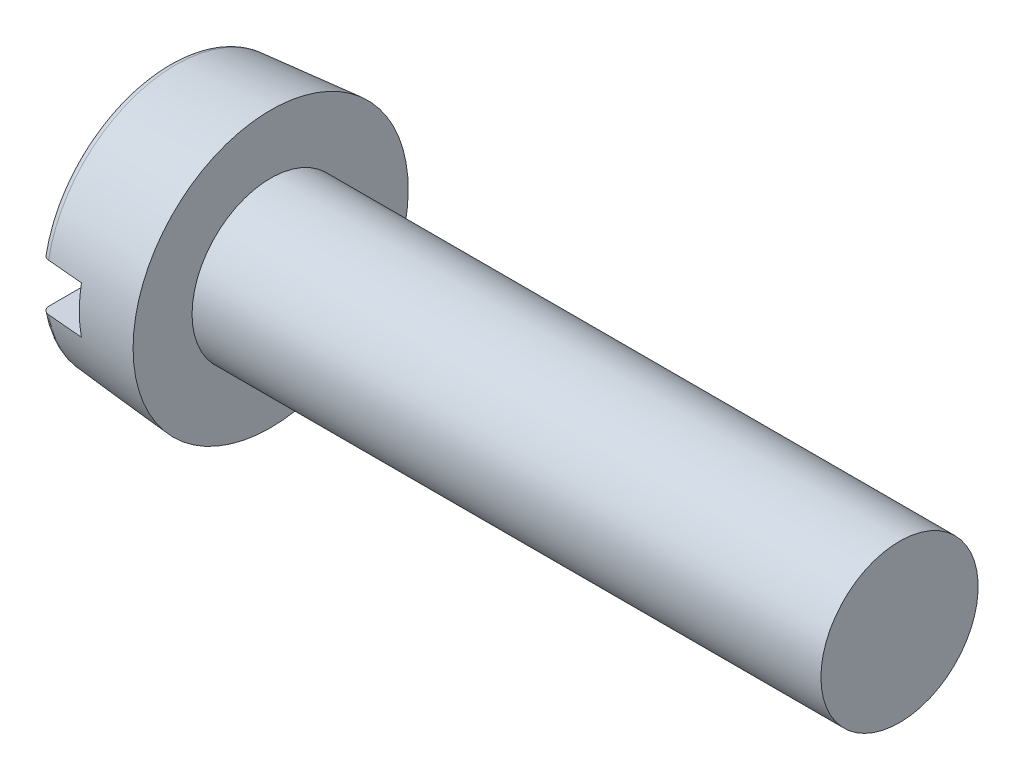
SolidWorks part; units mm, degrees
ref_plane "Plane1" through (0, 0, 0) normal (0, 0, 1) x (1, 0, 0)
ref_plane "Plane2" through (0, 0, 0) normal (0, 1, 0) x (1, 0, 0)
ref_plane "Plane3" through (0, 0, 0) normal (1, 0, 0) x (0, 0, -1)
sketch "BodySke" plane through (0, 0, 0) normal (0, 0, 1) x (1, 0, 0)
  line L0 (2.6, 2) -> (2.6, 3.5)
  line L1 (0, 0) -> (0, 3.2725)
  line L2 (-25.4, 0) -> (127, 0) construction
  line L3 (18.6, 0) -> (0, 0)
  line L4 (2.6, 2) -> (18.6, 2)
  line L5 (18.6, 2) -> (18.6, 0)
  line L6 (0, 3.2725) -> (2.6, 3.5)
  line L9 (3.3, 3.5875) -> (3.3, -5.9375) construction
  line L10 (2.6, 6.35) -> (2.6, -3.175) construction
  dimension "Head_ht" = 2.6
  dimension "Diameter" = 4
  dimension "Length" = 16
  dimension "Head_dia" = 7
  dimension "Advance" = 0.7
  dimension "Thread_nom" = 16
  dimension "Head_side_angle" = 5
revolve "Base-Revolve" add sketch "BodySke"
fillet "Fillet1" [suppressed] radius 0.2
fillet "Fillet2" radius 0.2 1 edges at (0, 0, 3.2725)
sketch "Sketch2" plane through (0, 0, 0) normal (1, 0, 0) x (0, 0, -1)
  line L0 (3.5, -0.6) -> (-3.5, -0.6)
  line L1 (3.5, -0.6) -> (3.5, 0.6)
  line L2 (-3.5, 0.6) -> (3.5, 0.6)
  line L3 (-3.5, 0.6) -> (-3.5, -0.6)
  dimension "D1" = 7
  dimension "D2" = 3.5
  dimension "Slot_width" = 1.2
  dimension "D3" = 0.6
extrude "Slot" cut sketch "Sketch2" along normal blind 1.1
sketch "ThdSchSke" plane through (0, 0, 0) normal (0, 0, 1) x (1, 0, 0)
  line L0 (4, -1.61) -> (3.7269, -2)
  line L1 (4, -1.61) -> (4.2731, -2)
  line L2 (4.2731, -2) -> (4.2731, -2.5)
  line L3 (-3.175, 0) -> (5.1513, 0) construction
  line L5 (4.2731, -2.5) -> (3.7269, -2.5)
  line L6 (3.7269, -2.5) -> (3.7269, -2)
  dimension "Thread_minor" = 3.22
  dimension "Diameter" = 4
  dimension "Start" = 4
  dimension "SideAngle" = 55
  dimension "VeeAngle" = 70
  dimension "Overcut" = 5
revolve "ThreadSchematic" [suppressed] cut sketch "ThdSchSke" angle 360 about L3
pattern_linear "ThdSchPat" [suppressed]
equation "\"D1@Sketch2\" = \"Head_dia@BodySke\""
equation "\"D2@Sketch2\" = \"D1@Sketch2\" / 2"
equation "\"D3@Sketch2\" = \"Slot_width@Sketch2\" / 2"
equation "\"Thread_length@ThreadCosmetic\" = ((sgn( (\"Length@BodySke\" - \"Advance@BodySke\" * 2.0 ) - \"Thread_nom@BodySke\" )-1)*( (\"Length@BodySke\" - \"Advance@BodySke\"  * 2.0) - \"Thread_nom@BodySke\" ))/-2+ \"Thread_"
equation "\"Thread_minor@ThdSchSke\" = \"Thread_minor@ThreadCosmetic\""
equation "\"Diameter@ThdSchSke\" = \"Diameter@BodySke\""
equation "\"Overcut@ThdSchSke\" = \"Diameter@BodySke\" * 1.25"
equation "\"Start@ThdSchSke\" = \"Head_ht@BodySke\" + \"Length@BodySke\" - \"Thread_length@ThreadCosmetic\"  '---Non-countersunk---"
equation "\"Num_threads@ThdSchPat\" = int( \"Thread_length@ThreadCosmetic\" / \"Advance@BodySke\" + 0.999 )  + 1"
equation "\"Advance@ThdSchPat\" = \"Thread_length@ThreadCosmetic\" /  (\"Num_threads@ThdSchPat\" - 1) 'relax it"
